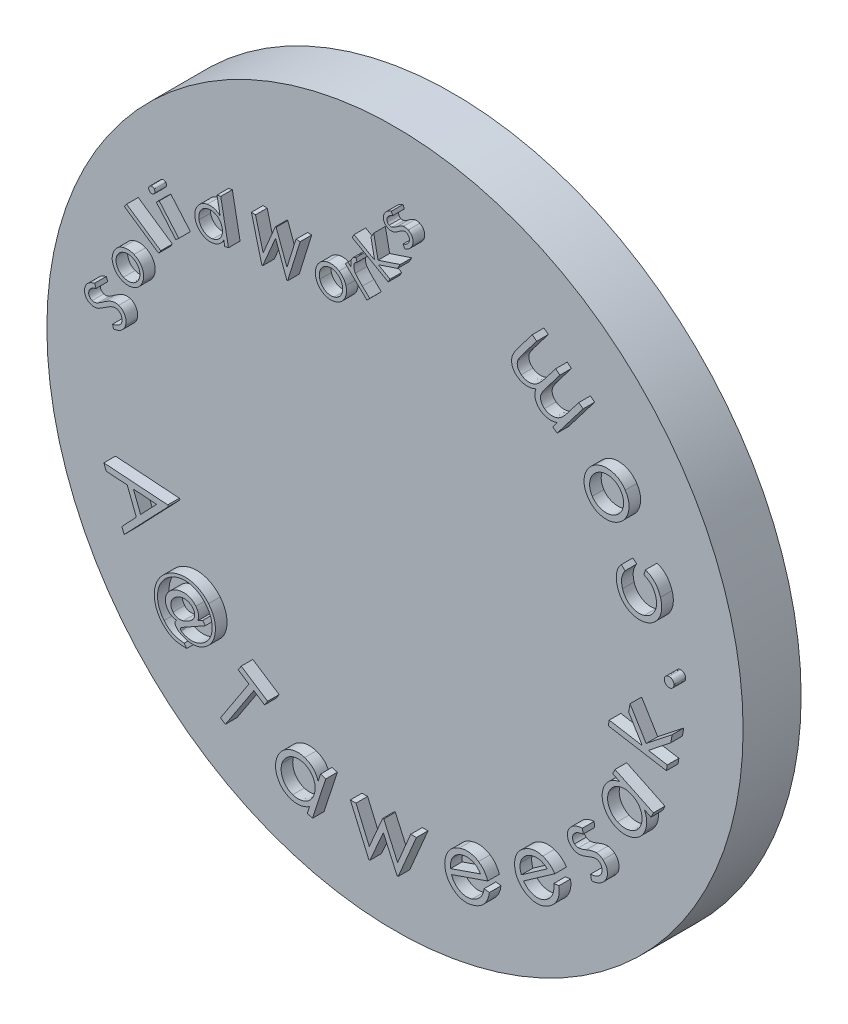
SolidWorks part; units mm, degrees
ref_plane "Front Plane" through (0, 0, 0) normal (0, 0, 1) x (1, 0, 0)
ref_plane "Top Plane" through (0, 0, 0) normal (0, 1, 0) x (1, 0, 0)
ref_plane "Right Plane" through (0, 0, 0) normal (1, 0, 0) x (0, 0, -1)
sketch "Sketch1" plane through (0, 0, 0) normal (0, 0, 1) x (1, 0, 0)
  circle A0 centre (0, 0) radius 30
  dimension "D1" = 60
extrude "Extrude1" add sketch "Sketch1" along normal blind 5
sketch "Sketch2"
  dimension "D2" = 5
  dimension "D1" = 135
  dimension "D3" = 60
extrude "Extrude2" add sketch "Sketch2" along normal blind 1
